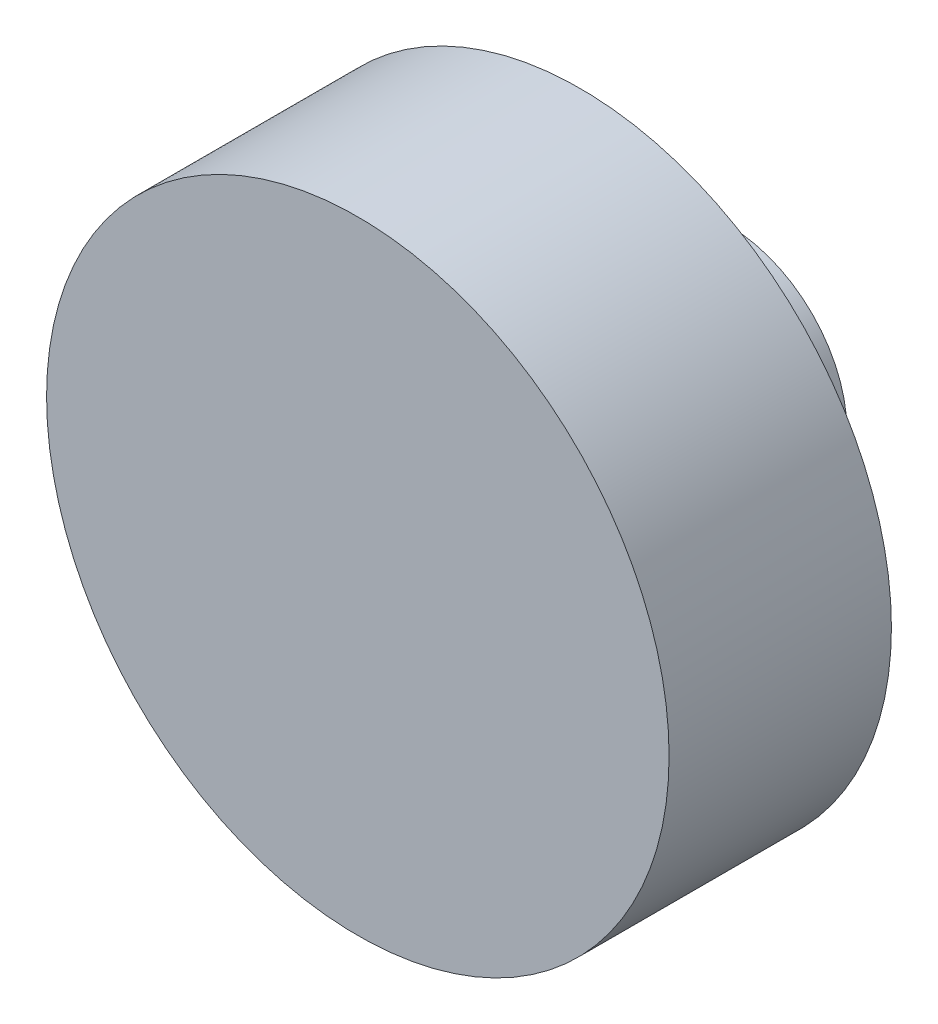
SolidWorks part; units mm, degrees
ref_plane "Front Plane" through (0, 0, 0) normal (0, 0, 1) x (1, 0, 0)
ref_plane "Top Plane" through (0, 0, 0) normal (0, 1, 0) x (1, 0, 0)
ref_plane "Right Plane" through (0, 0, 0) normal (1, 0, 0) x (0, 0, -1)
sketch "Sketch1" plane through (0, 0, 0) normal (0, 0, 1) x (1, 0, 0)
  circle A0 centre (-74.7808, 0) radius 8
extrude "Extrude1" add sketch "Sketch1" along normal blind 10
sketch "Sketch2" plane through (0, 0, 10) normal (0, 0, 1) x (1, 0, 0)
  circle A0 centre (-74.7808, 0) radius 21
  circle A1 centre (-74.7808, 0) radius 8 construction
  dimension "D1" = 42
extrude "Extrude2" add sketch "Sketch2" along normal blind 15
